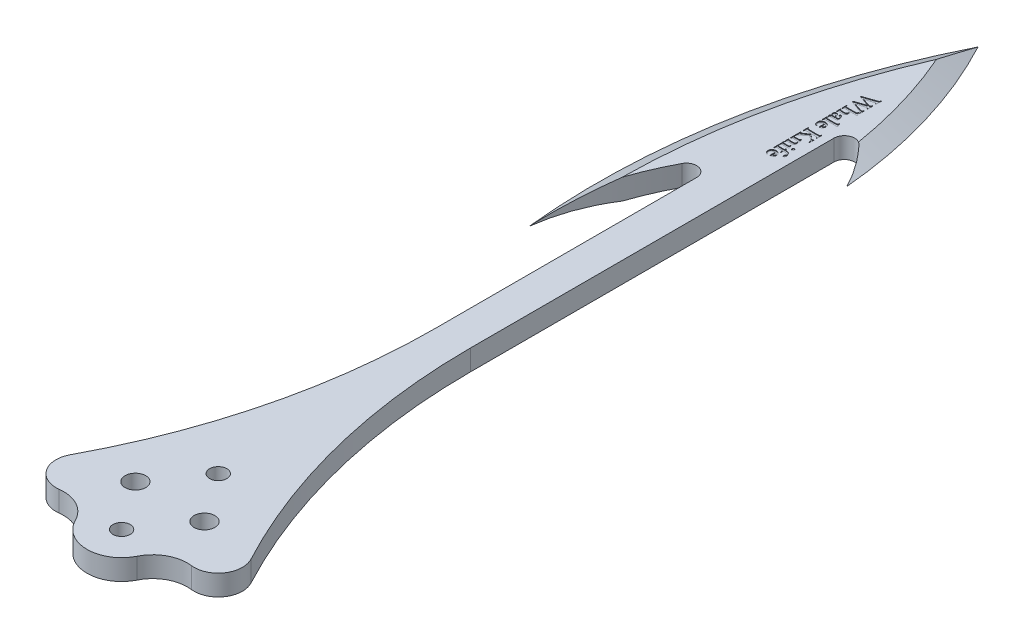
SolidWorks part; units mm, degrees
ref_plane "Front Plane" through (0, 0, 0) normal (0, 0, 1) x (1, 0, 0)
ref_plane "Top Plane" through (0, 0, 0) normal (0, 1, 0) x (1, 0, 0)
ref_plane "Right Plane" through (0, 0, 0) normal (1, 0, 0) x (0, 0, -1)
sketch "Sketch1" plane through (0, 0, 0) normal (0, 1, 0) x (1, 0, 0)
  line L0 (0, 0) -> (0, 120)
  line L1 (-10, 0) -> (10, 0)
  line L2 (-2.5, 0) -> (-2.5, 87)
  line L3 (2.5, 0) -> (2.5, 100)
  line L5 (-2.5, 0) -> (-2.5, 120) construction
  line L6 (2.5, 0) -> (2.5, 120) construction
  arc A0 (-4.481, -6.2182) -> (-9.5726, -3.4738) centre (-8.9621, -8.4364) ccw
  arc A1 (9.5726, -3.4738) -> (4.481, -6.2182) centre (8.9621, -8.4364) ccw
  circle A2 centre (-10, 0) radius 3.5
  circle A3 centre (10, 0) radius 3.5
  circle A4 centre (0, -4) radius 5
  arc A5 (0, 120) -> (-10, 65) centre (89.4656, 75.3244) ccw
  arc A6 (0, 120) -> (8, 93) centre (-61.7441, 87.0203) cw
  arc A7 (-10, 65) -> (-2.5, 87) centre (29.9772, 63.6498) cw
  arc A8 (8, 93) -> (2.5, 100) centre (-6.8344, 87.0051) ccw
  arc A9 (-13.0882, 1.6471) -> (-2.5, 44) centre (-92.5, 44) ccw
  arc A10 (2.5, 44) -> (13.0882, 1.6471) centre (92.5, 44) ccw
extrude "Boss-Extrude1" add sketch "Sketch1" along normal mid plane 3
fillet "Fillet1" radius 1.5 2 edges at (2.5, 0, -100) (-2.5, 0, -87)
chamfer "Chamfer1" distance 1.5 angle 60 1 edges at (-8.9214, 1.5, -93.213)
chamfer "Chamfer2" distance 1.5 angle 60 1 edges at (-8.9214, -1.5, -93.213)
chamfer "Chamfer3" distance 1.5 angle 60 1 edges at (5.8172, 1.5, -105.3361)
chamfer "Chamfer4" distance 1.5 angle 60 1 edges at (5.8172, -1.5, -105.3361)
sketch "Sketch2" plane through (0, 1.5, 0) normal (0, 1, 0) x (1, 0, 0)
  line L0 (-5, 3) -> (5, 3)
  line L1 (0, 10) -> (0, -4)
  circle A0 centre (-5, 3) radius 1.5
  circle A1 centre (5, 3) radius 1.5
  circle A2 centre (0, 10) radius 1.25
  circle A3 centre (0, -4) radius 1.25
extrude "Cut-Extrude1" cut sketch "Sketch2" against normal through all
sketch "Sketch3" plane through (0, 1.5, 0) normal (0, 1, 0) x (1, 0, 0)
  line L0 (0.7964, 103.1836) -> (0.7966, 103.172)
  line L1 (0.7966, 103.172) -> (-0.7008, 102.6592)
  line L2 (1.2033, 101.7026) -> (1.2037, 101.6428)
  line L3 (1.2239, 101.6231) -> (1.2931, 101.6228)
  line L4 (1.3054, 101.64) -> (1.3059, 102.2128)
  line L5 (1.2853, 102.2363) -> (1.2241, 102.236)
  line L6 (1.2033, 102.2158) -> (1.2037, 102.1372)
  line L7 (-0.2226, 102.4571) -> (-0.2225, 102.4684)
  line L8 (-0.2225, 102.4684) -> (1.0927, 102.8867)
  line L9 (1.2033, 102.8228) -> (1.2037, 102.7211)
  line L10 (1.2239, 102.7009) -> (1.2829, 102.7008)
  line L11 (1.3054, 102.7211) -> (1.3059, 103.4574)
  line L12 (1.2853, 103.4802) -> (1.2216, 103.4802)
  line L13 (1.2033, 103.4604) -> (1.2037, 103.4004)
  line L14 (-0.2143, 103.6597) -> (-0.2112, 103.6652)
  line L15 (-0.2112, 103.6652) -> (1.1041, 104.0837)
  line L16 (1.2033, 104.0156) -> (1.2037, 103.9613)
  line L17 (1.2239, 103.9357) -> (1.288, 103.9356)
  line L18 (1.3054, 103.9588) -> (1.3059, 104.6758)
  line L19 (1.2877, 104.6989) -> (1.2216, 104.6986)
  line L20 (1.2033, 104.6816) -> (1.2037, 104.6018)
  line L21 (1.1012, 104.4826) -> (-0.7179, 103.8521)
  line L22 (-0.5945, 100.7083) -> (-0.5945, 100.7598)
  line L23 (-0.6105, 100.7812) -> (-0.6733, 100.7811)
  line L24 (-0.6917, 100.7569) -> (-0.6917, 100.1761)
  line L25 (-0.6707, 100.1536) -> (-0.6129, 100.1533)
  line L26 (-0.5945, 100.182) -> (-0.5945, 100.233)
  line L27 (-0.55, 100.3302) -> (-0.1815, 100.3298)
  line L28 (-0.1815, 100.3298) -> (-0.014, 100.3298)
  line L29 (0.3372, 101.1288) -> (0.3376, 101.147)
  line L30 (0.3376, 101.147) -> (0.5154, 101.147)
  line L31 (1.1148, 101.6387) -> (1.0869, 101.6386)
  line L32 (1.0645, 101.6161) -> (1.0479, 101.5646)
  line L33 (0.7968, 101.434) -> (-0.2038, 101.4282)
  line L34 (-0.5945, 101.5362) -> (-0.5945, 101.6073)
  line L35 (-0.613, 101.633) -> (-0.6707, 101.6329)
  line L36 (-0.6917, 101.6103) -> (-0.6917, 101.0128)
  line L37 (-0.6657, 100.9888) -> (-0.6181, 100.9884)
  line L38 (-0.5945, 101.0193) -> (-0.5945, 101.0921)
  line L39 (-0.4775, 101.147) -> (0.1255, 101.147)
  line L40 (-0.0784, 100.6169) -> (-0.2652, 100.6165)
  line L41 (-0.5084, 98.8636) -> (-0.4857, 98.8974)
  line L42 (-0.3461, 99.091) -> (-0.2117, 99.091)
  line L43 (-0.2117, 99.091) -> (0.23, 99.0965)
  line L44 (0.1877, 99.378) -> (0.0427, 99.3776)
  line L45 (-0.5446, 99.3611) -> (-0.5445, 99.35)
  line L46 (-0.0632, 99.378) -> (-0.4308, 99.3776)
  line L47 (0.2725, 98.6132) -> (-0.4938, 98.6132)
  line L48 (-0.5945, 98.6844) -> (-0.5945, 98.7925)
  line L49 (-0.6159, 98.8327) -> (-0.6654, 98.8324)
  line L50 (-0.6917, 98.8097) -> (-0.6917, 98.1216)
  line L51 (-0.6657, 98.1045) -> (-0.6181, 98.1045)
  line L52 (-0.5945, 98.1387) -> (-0.5945, 98.2468)
  line L53 (-0.0076, 98.3265) -> (0.3955, 98.3265)
  line L54 (1.1308, 98.8438) -> (1.0974, 98.8438)
  line L55 (1.0748, 98.827) -> (1.0583, 98.7698)
  line L56 (0.3812, 98.6136) -> (0.2725, 98.6132)
  line L57 (0.02, 97.7203) -> (0.02, 97.0334)
  line L58 (-0.3651, 96.9332) -> (-0.3398, 96.9753)
  line L59 (-0.0661, 97.7203) -> (0.02, 97.7203)
  line L60 (0.1172, 97.364) -> (0.1172, 97.7117)
  line L61 (0.2836, 95.5588) -> (0.2836, 95.5079)
  line L62 (-0.5949, 94.9254) -> (-0.5946, 94.9646)
  line L63 (-0.6101, 94.9818) -> (-0.6737, 94.9816)
  line L64 (-0.6941, 94.9649) -> (-0.6941, 94.189)
  line L65 (-0.674, 94.1663) -> (-0.6099, 94.1662)
  line L66 (-0.592, 94.1894) -> (-0.592, 94.2516)
  line L67 (1.2033, 94.3994) -> (1.2037, 94.3426)
  line L68 (1.2239, 94.3204) -> (1.288, 94.3199)
  line L69 (1.3054, 94.3426) -> (1.3059, 94.9194)
  line L70 (1.2853, 94.9365) -> (1.2241, 94.9363)
  line L71 (1.2062, 94.9225) -> (1.2063, 94.8797)
  line L72 (0.3808, 95.5082) -> (0.3808, 95.5588)
  line L73 (0.3808, 95.5588) -> (0.5044, 95.5588)
  line L74 (1.2033, 95.4629) -> (1.2037, 95.3721)
  line L75 (1.2239, 95.3496) -> (1.288, 95.3494)
  line L76 (1.3054, 95.3723) -> (1.3059, 96.0747)
  line L77 (1.2902, 96.0975) -> (1.2216, 96.0975)
  line L78 (1.2033, 96.0749) -> (1.2037, 95.9893)
  line L79 (0.5208, 95.8986) -> (0.3579, 95.8982)
  line L80 (-0.592, 95.9839) -> (-0.592, 96.0861)
  line L81 (-0.6077, 96.1033) -> (-0.6763, 96.1032)
  line L82 (-0.6941, 96.0864) -> (-0.6941, 95.3721)
  line L83 (-0.674, 95.3554) -> (-0.6048, 95.3551)
  line L84 (-0.592, 95.378) -> (-0.592, 95.4853)
  line L85 (0.0723, 95.5588) -> (0.2836, 95.5588)
  line L86 (0.326, 94.1128) -> (0.3035, 94.1127)
  line L87 (0.275, 94.0901) -> (0.2639, 94.0672)
  line L88 (0.0995, 93.948) -> (-0.5378, 93.9476)
  line L89 (-0.5945, 94.0218) -> (-0.5945, 94.0786)
  line L90 (-0.6159, 94.1074) -> (-0.6654, 94.107)
  line L91 (-0.6917, 94.0901) -> (-0.6917, 93.546)
  line L92 (-0.6657, 93.5226) -> (-0.6181, 93.5224)
  line L93 (-0.5945, 93.5522) -> (-0.5945, 93.605)
  line L94 (-0.4985, 93.661) -> (0.0854, 93.661)
  line L95 (0.0653, 93.1573) -> (-0.2602, 93.1569)
  line L96 (-0.5945, 93.2219) -> (-0.5945, 93.2807)
  line L97 (-0.6159, 93.3162) -> (-0.6601, 93.316)
  line L98 (-0.6917, 93.2928) -> (-0.6917, 92.7136)
  line L99 (-0.6736, 92.691) -> (-0.6129, 92.6908)
  line L100 (-0.5945, 92.7252) -> (-0.5945, 92.8047)
  line L101 (-0.2436, 92.8706) -> (0.1647, 92.8702)
  line L102 (0.3429, 93.6523) -> (0.3432, 93.6691)
  line L103 (0.3432, 93.6691) -> (0.483, 93.691)
  line L104 (0.4937, 93.7788) -> (0.3545, 94.0843)
  line L105 (-0.5945, 92.4439) -> (-0.5945, 92.5689)
  line L106 (-0.6159, 92.5975) -> (-0.6654, 92.5974)
  line L107 (-0.6917, 92.5749) -> (-0.6917, 91.935)
  line L108 (-0.6657, 91.9122) -> (-0.6129, 91.9122)
  line L109 (-0.5945, 91.941) -> (-0.5945, 92.0545)
  line L110 (-0.2802, 92.1058) -> (0.0235, 92.1058)
  line L111 (0.3409, 92.5691) -> (0.31, 92.5689)
  line L112 (0.1102, 92.3928) -> (-0.2855, 92.3924)
  line L113 (0.9863, 92.1058) -> (0.9864, 92.1058)
  line L114 (0.3602, 91.3414) -> (0.3602, 91.0311)
  line L115 (0.373, 90.9942) -> (0.4656, 90.9798)
  line L116 (0.4887, 91.0028) -> (0.4887, 91.3414)
  line L117 (0.4887, 91.3414) -> (0.5784, 91.3414)
  line L118 (0.5419, 91.6284) -> (0.4887, 91.628)
  line L119 (0.4887, 91.628) -> (0.4887, 91.7874)
  line L120 (0.4755, 91.8245) -> (0.3885, 91.8358)
  line L121 (0.3598, 91.822) -> (0.3602, 91.628)
  line L122 (0.3602, 91.628) -> (-0.4973, 91.628)
  line L123 (-0.5945, 91.7022) -> (-0.5945, 91.8159)
  line L124 (-0.6105, 91.8447) -> (-0.6707, 91.8444)
  line L125 (-0.6917, 91.822) -> (-0.6917, 91.1165)
  line L126 (-0.6657, 91.0996) -> (-0.6181, 91.0994)
  line L127 (-0.5945, 91.128) -> (-0.5945, 91.2588)
  line L128 (0.1086, 91.3414) -> (0.3602, 91.3414)
  line L129 (0.02, 90.6033) -> (0.02, 89.9165)
  line L130 (-0.3651, 89.8162) -> (-0.3398, 89.8583)
  line L131 (-0.0661, 90.6033) -> (0.02, 90.6033)
  line L132 (0.1172, 90.247) -> (0.1172, 90.5947)
  spline S0 degree 3 poles (-0.7179, 103.8521) (-0.7308, 103.849) (-0.7548, 103.8349) (-0.764, 103.8086) (-0.7637, 103.7957) knots 0 0 0 0 0.508661 1 1 1 1
  spline S1 degree 3 poles (-0.7637, 103.7957) (-0.7618, 103.7798) (-0.7519, 103.7473) (-0.724, 103.7278) (-0.7094, 103.7219) knots 0 0 0 0 0.503971 1 1 1 1
  spline S2 degree 3 poles (-0.7094, 103.7219) (-0.6964, 103.7172) (-0.6719, 103.7086) (-0.6329, 103.6944) (-0.5894, 103.6789) (-0.5364, 103.6598) (-0.4739, 103.6371) (-0.4016, 103.6113) (-0.2341, 103.5512) (0.0265, 103.4573) (0.2882, 103.3639) (0.4585, 103.3029) (0.5335, 103.2761) (0.5994, 103.2526) (0.6562, 103.2325) (0.7041, 103.2155) (0.7498, 103.1997) (0.7796, 103.1892) (0.7964, 103.1836) knots 0 0 0 0 0.025988 0.048719 0.077721 0.112753 0.154386 0.202533 0.256709 0.488244 0.722134 0.777939 0.827714 0.871461 0.909178 0.940866 0.966768 1 1 1 1
  spline S3 degree 3 poles (-0.7008, 102.6592) (-0.717, 102.6552) (-0.7505, 102.6397) (-0.762, 102.6048) (-0.7637, 102.5885) knots 0 0 0 0 0.504998 1 1 1 1
  spline S4 degree 3 poles (-0.7637, 102.5885) (-0.7632, 102.5791) (-0.7591, 102.5655) (-0.7484, 102.55) (-0.727, 102.5323) (-0.7067, 102.5212) (-0.6896, 102.5148) knots 0 0 0 0 0.253597 0.376468 0.505659 1 1 1 1
  spline S5 degree 3 poles (-0.6896, 102.5148) (-0.6667, 102.5047) (-0.6271, 102.4881) (-0.5675, 102.464) (-0.5079, 102.4405) (-0.4386, 102.4134) (-0.3592, 102.3829) (-0.2699, 102.3488) (-0.0693, 102.2721) (0.2376, 102.1569) (0.5431, 102.0423) (0.7388, 101.9687) (0.8237, 101.9372) (0.8975, 101.9089) (0.9607, 101.8852) (1.0132, 101.8655) (1.0615, 101.8467) (1.0924, 101.8348) (1.1094, 101.8282) knots 0 0 0 0 0.03901 0.066931 0.100055 0.13886 0.182869 0.232561 0.287734 0.517462 0.743184 0.796179 0.843216 0.88417 0.919366 0.948404 0.971561 1 1 1 1
  spline S6 degree 3 poles (1.1094, 101.8282) (1.1245, 101.8215) (1.1452, 101.8094) (1.1685, 101.7891) (1.192, 101.7579) (1.2039, 101.7276) (1.2033, 101.7026) knots 0 0 0 0 0.297645 0.43121 0.556814 1 1 1 1
  spline S7 degree 3 poles (1.2037, 101.6428) (1.2033, 101.6373) (1.206, 101.6242) (1.219, 101.6217) (1.2239, 101.6231) knots 0 0 0 0 0.530048 1 1 1 1
  spline S8 degree 2 poles (1.2931, 101.6228) (1.3068, 101.6252) (1.3054, 101.64) knots 0 0 0 1 1 1
  spline S9 degree 3 poles (1.3059, 102.2128) (1.3059, 102.219) (1.3031, 102.2321) (1.2909, 102.2377) (1.2853, 102.2363) knots 0 0 0 0 0.542785 1 1 1 1
  spline S10 degree 3 poles (1.2241, 102.236) (1.2192, 102.2373) (1.2057, 102.235) (1.2036, 102.2212) (1.2033, 102.2158) knots 0 0 0 0 0.467009 1 1 1 1
  spline S11 degree 3 poles (1.2037, 102.1372) (1.2022, 102.1224) (1.2012, 102.1005) (1.1897, 102.0759) (1.1793, 102.0619) (1.1667, 102.0517) (1.149, 102.0415) (1.1339, 102.0382) (1.1238, 102.0387) knots 0 0 0 0 0.318444 0.449384 0.569347 0.682502 0.788889 1 1 1 1
  spline S12 degree 3 poles (1.1238, 102.0387) (1.0897, 102.0425) (1.034, 102.053) (0.954, 102.0727) (0.879, 102.0924) (0.7945, 102.1169) (0.7003, 102.1459) (0.5961, 102.1786) (0.4854, 102.2155) (0.3733, 102.2527) (0.266, 102.289) (0.1662, 102.3228) (0.074, 102.3541) (-0.011, 102.3828) (-0.109, 102.4169) (-0.1788, 102.4412) (-0.2226, 102.4571) knots 0 0 0 0 0.072903 0.120326 0.175254 0.237506 0.307386 0.384821 0.469629 0.555452 0.63583 0.710395 0.779424 0.842915 0.900965 1 1 1 1
  spline S13 degree 3 poles (1.0927, 102.8867) (1.1048, 102.8911) (1.1239, 102.8922) (1.1488, 102.8884) (1.1663, 102.8823) (1.1822, 102.8734) (1.1984, 102.8544) (1.2033, 102.8356) (1.2033, 102.8228) knots 0 0 0 0 0.256216 0.379413 0.505342 0.628167 0.741841 1 1 1 1
  spline S14 degree 3 poles (1.2037, 102.7211) (1.2033, 102.7157) (1.2066, 102.7035) (1.2187, 102.7002) (1.2239, 102.7009) knots 0 0 0 0 0.515562 1 1 1 1
  spline S15 degree 3 poles (1.2829, 102.7008) (1.2884, 102.6997) (1.3028, 102.7015) (1.3059, 102.7156) (1.3054, 102.7211) knots 0 0 0 0 0.504994 1 1 1 1
  spline S16 degree 3 poles (1.3059, 103.4574) (1.306, 103.4634) (1.3032, 103.4766) (1.2907, 103.4812) (1.2853, 103.4802) knots 0 0 0 0 0.542278 1 1 1 1
  spline S17 degree 3 poles (1.2216, 103.4802) (1.2162, 103.4807) (1.2065, 103.4757) (1.2023, 103.4657) (1.2033, 103.4604) knots 0 0 0 0 0.502979 1 1 1 1
  spline S18 degree 3 poles (1.2037, 103.4004) (1.203, 103.3824) (1.1946, 103.3442) (1.1673, 103.316) (1.1522, 103.3039) knots 0 0 0 0 0.481174 1 1 1 1
  spline S19 degree 3 poles (1.1522, 103.3039) (1.1313, 103.2874) (1.0821, 103.2647) (1.0292, 103.2524) (1.0015, 103.2528) knots 0 0 0 0 0.489905 1 1 1 1
  spline S20 degree 3 poles (1.0015, 103.2528) (0.9705, 103.2592) (0.9187, 103.2718) (0.8435, 103.2942) (0.7706, 103.3165) (0.6869, 103.3431) (0.5925, 103.3746) (0.4875, 103.4104) (0.3943, 103.4432) (0.3172, 103.4698) (0.2611, 103.4897) (0.208, 103.5087) (0.1578, 103.5264) (0.1104, 103.5427) (0.0662, 103.5584) (0.0252, 103.5734) (-0.0133, 103.5868) (-0.0486, 103.5998) (-0.0812, 103.6111) (-0.1106, 103.6219) (-0.1372, 103.6313) (-0.1606, 103.6401) (-0.1861, 103.6491) (-0.2036, 103.6558) (-0.2143, 103.6597) knots 0 0 0 0 0.073994 0.124496 0.183608 0.252355 0.329829 0.416342 0.511898 0.560844 0.607152 0.651128 0.692663 0.731758 0.768217 0.802344 0.83403 0.863383 0.890295 0.914875 0.936712 0.956217 0.97328 1 1 1 1
  spline S21 degree 3 poles (1.1041, 104.0837) (1.1175, 104.0872) (1.1374, 104.0907) (1.1618, 104.0859) (1.1765, 104.0795) (1.1877, 104.0683) (1.1995, 104.0476) (1.203, 104.0288) (1.2033, 104.0156) knots 0 0 0 0 0.289357 0.4051 0.511719 0.614061 0.725985 1 1 1 1
  spline S22 degree 3 poles (1.2037, 103.9613) (1.2038, 103.9547) (1.2051, 103.9401) (1.2184, 103.9344) (1.2239, 103.9357) knots 0 0 0 0 0.564891 1 1 1 1
  spline S23 degree 3 poles (1.288, 103.9356) (1.293, 103.9345) (1.305, 103.9397) (1.3055, 103.953) (1.3054, 103.9588) knots 0 0 0 0 0.439613 1 1 1 1
  spline S24 degree 3 poles (1.3059, 104.6758) (1.3058, 104.6814) (1.3042, 104.6937) (1.293, 104.6995) (1.2877, 104.6989) knots 0 0 0 0 0.534185 1 1 1 1
  spline S25 degree 2 poles (1.2216, 104.6986) (1.2047, 104.6984) (1.2033, 104.6816) knots 0 0 0 1 1 1
  spline S26 degree 3 poles (1.2037, 104.6018) (1.2041, 104.5782) (1.1939, 104.548) (1.1687, 104.5194) (1.1419, 104.5003) (1.1186, 104.4887) (1.1012, 104.4826) knots 0 0 0 0 0.417219 0.538345 0.672718 1 1 1 1
  spline S27 degree 3 poles (-0.2652, 100.6165) (-0.3172, 100.6172) (-0.382, 100.6165) (-0.4577, 100.6179) (-0.497, 100.6196) (-0.5234, 100.6205) (-0.5389, 100.6227) knots 0 0 0 0 0.569257 0.710663 0.829562 1 1 1 1
  spline S28 degree 3 poles (-0.5389, 100.6227) (-0.5487, 100.6242) (-0.5626, 100.6292) (-0.577, 100.642) (-0.5906, 100.6663) (-0.5947, 100.6898) (-0.5945, 100.7083) knots 0 0 0 0 0.264681 0.383825 0.503697 1 1 1 1
  spline S29 degree 3 poles (-0.5945, 100.7598) (-0.5943, 100.7651) (-0.5953, 100.7771) (-0.6061, 100.7817) (-0.6105, 100.7812) knots 0 0 0 0 0.565398 1 1 1 1
  spline S30 degree 3 poles (-0.6733, 100.7811) (-0.6786, 100.7826) (-0.6914, 100.7769) (-0.6917, 100.7629) (-0.6917, 100.7569) knots 0 0 0 0 0.446871 1 1 1 1
  spline S31 degree 3 poles (-0.6917, 100.1761) (-0.6913, 100.1705) (-0.6898, 100.1563) (-0.676, 100.1527) (-0.6707, 100.1536) knots 0 0 0 0 0.525122 1 1 1 1
  spline S32 degree 3 poles (-0.6129, 100.1533) (-0.6073, 100.1521) (-0.5944, 100.1595) (-0.5944, 100.1748) (-0.5945, 100.182) knots 0 0 0 0 0.402209 1 1 1 1
  spline S33 degree 3 poles (-0.5945, 100.233) (-0.5946, 100.2548) (-0.5938, 100.2825) (-0.5822, 100.3114) (-0.5712, 100.3253) (-0.5583, 100.3295) (-0.55, 100.3302) knots 0 0 0 0 0.559196 0.680852 0.78476 1 1 1 1
  spline S34 degree 3 poles (-0.014, 100.3298) (0.0243, 100.3292) (0.0812, 100.3288) (0.1554, 100.3352) (0.2085, 100.3419) (0.26, 100.3547) (0.3273, 100.3853) (0.3706, 100.4223) (0.3969, 100.4501) knots 0 0 0 0 0.259639 0.383485 0.503439 0.621384 0.740581 1 1 1 1
  spline S35 degree 3 poles (0.3969, 100.4501) (0.4144, 100.4694) (0.4399, 100.4986) (0.4667, 100.5414) (0.4837, 100.5739) (0.4968, 100.6089) (0.509, 100.6628) (0.5128, 100.7057) (0.5122, 100.7355) knots 0 0 0 0 0.24764 0.364497 0.478454 0.593635 0.717874 1 1 1 1
  spline S36 degree 3 poles (0.5122, 100.7355) (0.5124, 100.7725) (0.506, 100.828) (0.4875, 100.9006) (0.4678, 100.9541) (0.4432, 101.0053) (0.4029, 101.0668) (0.3656, 101.1067) (0.3372, 101.1288) knots 0 0 0 0 0.249147 0.375475 0.504777 0.633682 0.757584 1 1 1 1
  spline S37 degree 3 poles (0.5154, 101.147) (0.5403, 101.147) (0.5799, 101.147) (0.6356, 101.147) (0.6842, 101.147) (0.7374, 101.1469) (0.795, 101.1471) (0.8572, 101.1464) (0.922, 101.1467) (0.9858, 101.1461) (1.045, 101.1457) (1.0977, 101.1455) (1.1439, 101.1444) (1.1834, 101.1442) (1.2231, 101.1434) (1.2496, 101.1417) (1.2651, 101.1412) knots 0 0 0 0 0.099556 0.158334 0.223155 0.294018 0.370924 0.453875 0.542866 0.630211 0.709316 0.779632 0.841167 0.893905 0.937865 1 1 1 1
  spline S38 degree 3 poles (1.2651, 101.1412) (1.2811, 101.1406) (1.3098, 101.1327) (1.333, 101.1522) (1.3318, 101.1634) knots 0 0 0 0 0.635029 1 1 1 1
  spline S39 degree 3 poles (1.3318, 101.1634) (1.3322, 101.1758) (1.3261, 101.2019) (1.3136, 101.2254) (1.3096, 101.2392) knots 0 0 0 0 0.460296 1 1 1 1
  spline S40 degree 3 poles (1.3096, 101.2392) (1.2958, 101.266) (1.2742, 101.3086) (1.2449, 101.3689) (1.2206, 101.4193) (1.1973, 101.4697) (1.1718, 101.5289) (1.1564, 101.5717) (1.1481, 101.5988) knots 0 0 0 0 0.2292 0.362711 0.50977 0.654551 0.785029 1 1 1 1
  spline S41 degree 3 poles (1.1481, 101.5988) (1.1425, 101.6106) (1.1355, 101.6266) (1.121, 101.6404) (1.1148, 101.6387) knots 0 0 0 0 0.693552 1 1 1 1
  spline S42 degree 3 poles (1.0869, 101.6386) (1.0818, 101.6396) (1.0705, 101.634) (1.0665, 101.6222) (1.0645, 101.6161) knots 0 0 0 0 0.421305 1 1 1 1
  spline S43 degree 3 poles (1.0479, 101.5646) (1.0392, 101.543) (1.0238, 101.5118) (0.9924, 101.48) (0.9658, 101.4613) (0.9333, 101.4482) (0.8768, 101.4356) (0.8301, 101.4336) (0.7968, 101.434) knots 0 0 0 0 0.229513 0.333094 0.43449 0.545306 0.673733 1 1 1 1
  spline S44 degree 3 poles (-0.2038, 101.4282) (-0.2706, 101.4285) (-0.3529, 101.4295) (-0.4484, 101.4325) (-0.4971, 101.4354) (-0.5302, 101.4391) (-0.55, 101.4423) knots 0 0 0 0 0.577999 0.712303 0.826554 1 1 1 1
  spline S45 degree 3 poles (-0.55, 101.4423) (-0.5657, 101.4479) (-0.5925, 101.4768) (-0.5952, 101.5159) (-0.5945, 101.5362) knots 0 0 0 0 0.438948 1 1 1 1
  spline S46 degree 3 poles (-0.5945, 101.6073) (-0.594, 101.6134) (-0.5961, 101.6265) (-0.6076, 101.6326) (-0.613, 101.633) knots 0 0 0 0 0.541635 1 1 1 1
  spline S47 degree 3 poles (-0.6707, 101.6329) (-0.6761, 101.633) (-0.6902, 101.63) (-0.6922, 101.6158) (-0.6917, 101.6103) knots 0 0 0 0 0.499346 1 1 1 1
  spline S48 degree 3 poles (-0.6917, 101.0128) (-0.6915, 101.0065) (-0.6876, 100.9912) (-0.6721, 100.988) (-0.6657, 100.9888) knots 0 0 0 0 0.501727 1 1 1 1
  spline S49 degree 3 poles (-0.6181, 100.9884) (-0.6116, 100.9891) (-0.595, 100.9945) (-0.5942, 101.0123) (-0.5945, 101.0193) knots 0 0 0 0 0.475426 1 1 1 1
  spline S50 degree 3 poles (-0.5945, 101.0921) (-0.5946, 101.1011) (-0.5928, 101.1153) (-0.581, 101.1292) (-0.5691, 101.1369) (-0.5528, 101.142) (-0.5219, 101.1463) (-0.4962, 101.1474) (-0.4775, 101.147) knots 0 0 0 0 0.188784 0.272441 0.363436 0.476058 0.618049 1 1 1 1
  spline S51 degree 3 poles (0.1255, 101.147) (0.1524, 101.147) (0.2012, 101.1332) (0.2443, 101.1073) (0.2622, 101.0922) knots 0 0 0 0 0.533521 1 1 1 1
  spline S52 degree 3 poles (0.2622, 101.0922) (0.2926, 101.0607) (0.3405, 100.99) (0.3614, 100.9071) (0.3623, 100.8665) knots 0 0 0 0 0.519834 1 1 1 1
  spline S53 degree 3 poles (0.3623, 100.8665) (0.3622, 100.8346) (0.353, 100.771) (0.3172, 100.7176) (0.2956, 100.696) knots 0 0 0 0 0.511725 1 1 1 1
  spline S54 degree 3 poles (0.2956, 100.696) (0.276, 100.6765) (0.2396, 100.6529) (0.1832, 100.6343) (0.0814, 100.6171) (-0.007, 100.6156) (-0.0784, 100.6169) knots 0 0 0 0 0.210828 0.326179 0.45236 1 1 1 1
  spline S55 degree 3 poles (-0.5445, 99.35) (-0.5724, 99.3416) (-0.6112, 99.3236) (-0.6538, 99.2891) (-0.6781, 99.2602) (-0.6963, 99.2281) (-0.7135, 99.1814) (-0.7188, 99.1439) (-0.7184, 99.1186) knots 0 0 0 0 0.280176 0.404721 0.523526 0.640416 0.757194 1 1 1 1
  spline S56 degree 3 poles (-0.7184, 99.1186) (-0.717, 99.0826) (-0.7089, 99.0315) (-0.6827, 98.9711) (-0.6564, 98.9374) (-0.6285, 98.9105) (-0.5955, 98.8825) (-0.5705, 98.8654) (-0.5533, 98.8578) knots 0 0 0 0 0.331071 0.471427 0.601437 0.722165 0.828065 1 1 1 1
  spline S57 degree 3 poles (-0.5533, 98.8578) (-0.5436, 98.8557) (-0.5265, 98.8472) (-0.5098, 98.8567) (-0.5084, 98.8636) knots 0 0 0 0 0.623888 1 1 1 1
  spline S58 degree 3 poles (-0.4857, 98.8974) (-0.4826, 98.9011) (-0.4792, 98.9153) (-0.4932, 98.922) (-0.4973, 98.9262) knots 0 0 0 0 0.424956 1 1 1 1
  spline S59 degree 3 poles (-0.4973, 98.9262) (-0.511, 98.9342) (-0.5326, 98.963) (-0.5419, 98.9975) (-0.5418, 99.0172) knots 0 0 0 0 0.443069 1 1 1 1
  spline S60 degree 3 poles (-0.5418, 99.0172) (-0.5433, 99.0291) (-0.5371, 99.0468) (-0.5192, 99.0645) (-0.4991, 99.0747) (-0.4723, 99.0822) (-0.4208, 99.0905) (-0.3775, 99.0909) (-0.3461, 99.091) knots 0 0 0 0 0.151317 0.229566 0.323011 0.440459 0.590693 1 1 1 1
  spline S61 degree 3 poles (0.23, 99.0965) (0.2674, 99.0958) (0.3145, 99.0993) (0.3686, 99.1139) (0.4027, 99.1308) (0.425, 99.1488) (0.4385, 99.1626) knots 0 0 0 0 0.49817 0.621779 0.743418 1 1 1 1
  spline S62 degree 3 poles (0.4385, 99.1626) (0.4626, 99.1876) (0.4862, 99.2272) (0.5036, 99.2829) (0.5132, 99.3387) (0.5146, 99.3847) (0.5151, 99.4176) knots 0 0 0 0 0.379686 0.496488 0.638986 1 1 1 1
  spline S63 degree 3 poles (0.5151, 99.4176) (0.5149, 99.4626) (0.5089, 99.5288) (0.4907, 99.6141) (0.472, 99.6735) (0.4492, 99.7295) (0.4149, 99.7995) (0.3838, 99.8483) (0.361, 99.8788) knots 0 0 0 0 0.272762 0.402278 0.527902 0.650056 0.768849 1 1 1 1
  spline S64 degree 3 poles (0.361, 99.8788) (0.3457, 99.8989) (0.3212, 99.9274) (0.2831, 99.9583) (0.2534, 99.9769) (0.223, 99.991) (0.1834, 100.0058) (0.1523, 100.0097) (0.1321, 100.0098) knots 0 0 0 0 0.277679 0.409451 0.537377 0.660714 0.777469 1 1 1 1
  spline S65 degree 3 poles (0.1321, 100.0098) (0.1183, 100.009) (0.0978, 100.0064) (0.0745, 99.9936) (0.0608, 99.981) (0.0501, 99.9662) (0.0398, 99.9439) (0.0371, 99.9254) (0.0369, 99.913) knots 0 0 0 0 0.273864 0.397476 0.518237 0.638482 0.754789 1 1 1 1
  spline S66 degree 3 poles (0.0369, 99.913) (0.0375, 99.8873) (0.0427, 99.8504) (0.0609, 99.8071) (0.0791, 99.7821) (0.1025, 99.7631) (0.142, 99.7445) (0.1761, 99.7414) (0.1992, 99.7421) knots 0 0 0 0 0.287233 0.409052 0.519402 0.628013 0.741493 1 1 1 1
  spline S67 degree 3 poles (0.1992, 99.7421) (0.2273, 99.7421) (0.2597, 99.7496) (0.2977, 99.7531) (0.318, 99.7495) (0.3296, 99.7384) (0.3359, 99.731) knots 0 0 0 0 0.580588 0.68922 0.791117 1 1 1 1
  spline S68 degree 3 poles (0.3359, 99.731) (0.3539, 99.7068) (0.3768, 99.6525) (0.3864, 99.5945) (0.3862, 99.5658) knots 0 0 0 0 0.511395 1 1 1 1
  spline S69 degree 3 poles (0.3862, 99.5658) (0.3866, 99.5378) (0.384, 99.486) (0.3601, 99.4398) (0.3446, 99.4233) knots 0 0 0 0 0.557063 1 1 1 1
  spline S70 degree 3 poles (0.3446, 99.4233) (0.3252, 99.4048) (0.272, 99.3858) (0.2168, 99.3807) (0.1877, 99.378) knots 0 0 0 0 0.471436 1 1 1 1
  spline S71 degree 3 poles (0.0427, 99.3776) (0.0299, 99.3958) (0.0126, 99.4269) (-0.0112, 99.4716) (-0.0302, 99.5128) (-0.0517, 99.5591) (-0.0853, 99.6323) (-0.1121, 99.6901) (-0.1307, 99.7306) knots 0 0 0 0 0.169475 0.271042 0.38572 0.514934 0.660081 1 1 1 1
  spline S72 degree 3 poles (-0.1307, 99.7306) (-0.1514, 99.7735) (-0.1842, 99.8339) (-0.2422, 99.8981) (-0.2862, 99.9324) (-0.3323, 99.9561) (-0.3938, 99.9792) (-0.4426, 99.9849) (-0.4746, 99.9843) knots 0 0 0 0 0.315466 0.448091 0.568136 0.680706 0.788672 1 1 1 1
  spline S73 degree 3 poles (-0.4746, 99.9843) (-0.51, 99.9838) (-0.5606, 99.9771) (-0.6212, 99.9534) (-0.656, 99.9286) (-0.6836, 99.8997) (-0.7102, 99.8563) (-0.7187, 99.819) (-0.7184, 99.794) knots 0 0 0 0 0.30717 0.438759 0.561213 0.675981 0.783596 1 1 1 1
  spline S74 degree 3 poles (-0.7184, 99.794) (-0.7197, 99.7653) (-0.7184, 99.7042) (-0.7059, 99.6444) (-0.6983, 99.6132) knots 0 0 0 0 0.471941 1 1 1 1
  spline S75 degree 3 poles (-0.6983, 99.6132) (-0.6898, 99.5861) (-0.6751, 99.5475) (-0.6521, 99.4992) (-0.6167, 99.4373) (-0.5791, 99.3919) (-0.5446, 99.3611) knots 0 0 0 0 0.28457 0.414663 0.536917 1 1 1 1
  spline S76 degree 3 poles (-0.4308, 99.3776) (-0.4461, 99.3797) (-0.469, 99.3906) (-0.4957, 99.4149) (-0.5162, 99.4404) (-0.5352, 99.469) (-0.555, 99.5096) (-0.5633, 99.542) (-0.5656, 99.5638) knots 0 0 0 0 0.188184 0.305937 0.444487 0.59032 0.729895 1 1 1 1
  spline S77 degree 3 poles (-0.5656, 99.5638) (-0.5657, 99.5809) (-0.561, 99.6073) (-0.542, 99.6371) (-0.5236, 99.658) (-0.499, 99.6752) (-0.4561, 99.6924) (-0.4197, 99.6966) (-0.3943, 99.6972) knots 0 0 0 0 0.212222 0.319435 0.433396 0.553726 0.685868 1 1 1 1
  spline S78 degree 3 poles (-0.3943, 99.6972) (-0.3711, 99.6963) (-0.3374, 99.6916) (-0.2953, 99.6785) (-0.267, 99.6664) (-0.2416, 99.6504) (-0.2188, 99.6317) (-0.1984, 99.6102) (-0.1413, 99.5286) (-0.1015, 99.4477) (-0.0632, 99.378) knots 0 0 0 0 0.14218 0.207394 0.26994 0.330421 0.390224 0.450352 0.51179 1 1 1 1
  spline S79 degree 3 poles (-0.4938, 98.6132) (-0.5103, 98.6137) (-0.5332, 98.6168) (-0.5604, 98.6267) (-0.5834, 98.6453) (-0.595, 98.6667) (-0.5945, 98.6844) knots 0 0 0 0 0.359974 0.502513 0.62427 1 1 1 1
  spline S80 degree 3 poles (-0.5945, 98.7925) (-0.5961, 98.8025) (-0.5913, 98.8239) (-0.6089, 98.8355) (-0.6159, 98.8327) knots 0 0 0 0 0.633347 1 1 1 1
  spline S81 degree 3 poles (-0.6654, 98.8324) (-0.672, 98.8338) (-0.6869, 98.8303) (-0.6919, 98.8161) (-0.6917, 98.8097) knots 0 0 0 0 0.512163 1 1 1 1
  spline S82 degree 3 poles (-0.6917, 98.1216) (-0.6913, 98.1167) (-0.6854, 98.1046) (-0.6715, 98.1056) (-0.6657, 98.1045) knots 0 0 0 0 0.43507 1 1 1 1
  spline S83 degree 3 poles (-0.6181, 98.1045) (-0.6111, 98.102) (-0.5931, 98.1103) (-0.5948, 98.1303) (-0.5945, 98.1387) knots 0 0 0 0 0.423746 1 1 1 1
  spline S84 degree 3 poles (-0.5945, 98.2468) (-0.5941, 98.2595) (-0.5919, 98.2775) (-0.5806, 98.2972) (-0.555, 98.3168) (-0.5259, 98.3178) (-0.5051, 98.3212) knots 0 0 0 0 0.286795 0.399469 0.503039 1 1 1 1
  spline S85 degree 3 poles (-0.5051, 98.3212) (-0.4734, 98.3224) (-0.4207, 98.3247) (-0.3434, 98.3253) (-0.2725, 98.3262) (-0.1995, 98.3266) (-0.1109, 98.3265) (-0.0477, 98.3266) (-0.0076, 98.3265) knots 0 0 0 0 0.191315 0.317964 0.466131 0.61843 0.758312 1 1 1 1
  spline S86 degree 3 poles (0.3955, 98.3265) (0.4225, 98.3269) (0.4653, 98.3259) (0.5259, 98.3263) (0.5789, 98.3256) (0.637, 98.3254) (0.7001, 98.3243) (0.7682, 98.3242) (0.8396, 98.3232) (0.9109, 98.3225) (0.9788, 98.3216) (1.0417, 98.321) (1.0995, 98.3194) (1.1522, 98.319) (1.2125, 98.3169) (1.2552, 98.3167) (1.282, 98.3154) knots 0 0 0 0 0.091208 0.145098 0.205028 0.270533 0.341618 0.418737 0.50097 0.583203 0.659861 0.730946 0.795999 0.855471 0.909378 1 1 1 1
  spline S87 degree 3 poles (1.282, 98.3154) (1.295, 98.3171) (1.3181, 98.316) (1.3347, 98.3339) (1.3318, 98.343) knots 0 0 0 0 0.629647 1 1 1 1
  spline S88 degree 3 poles (1.3318, 98.343) (1.3316, 98.3504) (1.3273, 98.371) (1.3195, 98.3903) (1.3153, 98.4031) knots 0 0 0 0 0.354543 1 1 1 1
  spline S89 degree 3 poles (1.3153, 98.4031) (1.2991, 98.431) (1.2759, 98.4771) (1.2474, 98.5441) (1.2257, 98.6023) (1.2045, 98.6615) (1.1796, 98.7344) (1.1632, 98.7873) (1.1531, 98.8212) knots 0 0 0 0 0.215292 0.343836 0.485988 0.630085 0.763715 1 1 1 1
  spline S90 degree 2 poles (1.1531, 98.8212) (1.1483, 98.8398) (1.1308, 98.8438) knots 0 0 0 1 1 1
  spline S91 degree 3 poles (1.0974, 98.8438) (1.0929, 98.846) (1.0812, 98.8431) (1.0768, 98.8322) (1.0748, 98.827) knots 0 0 0 0 0.44852 1 1 1 1
  spline S92 degree 3 poles (1.0583, 98.7698) (1.0511, 98.7495) (1.0413, 98.7192) (1.0183, 98.6858) (1.0002, 98.6649) (0.9781, 98.6485) (0.9424, 98.631) (0.9115, 98.626) (0.8903, 98.6247) knots 0 0 0 0 0.271578 0.391623 0.504734 0.616375 0.73313 1 1 1 1
  spline S93 degree 3 poles (0.8903, 98.6247) (0.8627, 98.6229) (0.816, 98.6209) (0.7466, 98.6183) (0.6045, 98.6152) (0.4815, 98.6134) (0.3812, 98.6136) knots 0 0 0 0 0.162767 0.275259 0.409554 1 1 1 1
  spline S94 degree 3 poles (0.02, 97.0334) (0.0206, 97.0147) (0.0185, 96.9905) (0.0305, 96.9669) (0.0428, 96.9577) (0.0548, 96.9564) (0.0629, 96.9563) knots 0 0 0 0 0.565748 0.662956 0.760247 1 1 1 1
  spline S95 degree 3 poles (0.0629, 96.9563) (0.0815, 96.9554) (0.1106, 96.958) (0.1499, 96.9673) (0.1825, 96.9773) (0.2171, 96.99) (0.2533, 97.0063) (0.2917, 97.0252) (0.3311, 97.0469) (0.3696, 97.0722) (0.4044, 97.1026) (0.434, 97.1379) (0.4596, 97.1773) (0.4794, 97.2215) (0.502, 97.2878) (0.5092, 97.3416) (0.5122, 97.3784) knots 0 0 0 0 0.082096 0.12807 0.178063 0.232278 0.290561 0.353384 0.420605 0.489123 0.556052 0.623502 0.691862 0.762571 0.836672 1 1 1 1
  spline S96 degree 3 poles (0.5122, 97.3784) (0.5127, 97.434) (0.5093, 97.5138) (0.4893, 97.6128) (0.4692, 97.6755) (0.441, 97.7316) (0.3911, 97.8012) (0.3437, 97.8463) (0.3079, 97.8723) knots 0 0 0 0 0.298754 0.426755 0.541728 0.651555 0.762662 1 1 1 1
  spline S97 degree 3 poles (0.3079, 97.8723) (0.2723, 97.8983) (0.2193, 97.9328) (0.147, 97.9677) (0.0972, 97.9845) (0.0481, 97.9956) (-0.0198, 98.0064) (-0.0722, 98.0082) (-0.1077, 98.0073) knots 0 0 0 0 0.296297 0.423812 0.538755 0.648629 0.761622 1 1 1 1
  spline S98 degree 3 poles (-0.1077, 98.0073) (-0.1488, 98.0078) (-0.2096, 98.005) (-0.2887, 97.992) (-0.3458, 97.9787) (-0.4019, 97.9587) (-0.4779, 97.9201) (-0.5314, 97.882) (-0.5656, 97.8529) knots 0 0 0 0 0.249162 0.367973 0.485166 0.603539 0.728133 1 1 1 1
  spline S99 degree 3 poles (-0.5656, 97.8529) (-0.593, 97.83) (-0.6291, 97.7906) (-0.6657, 97.7302) (-0.6864, 97.6813) (-0.7013, 97.6283) (-0.717, 97.5495) (-0.7194, 97.4871) (-0.7193, 97.4443) knots 0 0 0 0 0.23653 0.351373 0.467296 0.587814 0.715927 1 1 1 1
  spline S100 degree 3 poles (-0.7193, 97.4443) (-0.7181, 97.408) (-0.7128, 97.3553) (-0.7008, 97.2877) (-0.6884, 97.242) (-0.6733, 97.1997) (-0.655, 97.1611) (-0.6341, 97.1258) (-0.6027, 97.0849) (-0.5618, 97.041) (-0.502, 96.9829) (-0.4535, 96.9491) (-0.4203, 96.9332) knots 0 0 0 0 0.174539 0.254455 0.330387 0.402041 0.469983 0.535443 0.599104 0.717843 0.823413 1 1 1 1
  spline S101 degree 3 poles (-0.4203, 96.9332) (-0.4084, 96.9291) (-0.3888, 96.9145) (-0.3665, 96.9244) (-0.3651, 96.9332) knots 0 0 0 0 0.637118 1 1 1 1
  spline S102 degree 3 poles (-0.3398, 96.9753) (-0.3367, 96.9799) (-0.3338, 96.9959) (-0.3488, 97.004) (-0.3539, 97.0086) knots 0 0 0 0 0.426517 1 1 1 1
  spline S103 degree 3 poles (-0.3539, 97.0086) (-0.3774, 97.0229) (-0.4086, 97.0512) (-0.4445, 97.0955) (-0.4686, 97.1345) (-0.4885, 97.1791) (-0.5091, 97.2497) (-0.5137, 97.3071) (-0.5146, 97.3467) knots 0 0 0 0 0.209969 0.320964 0.437433 0.561093 0.695222 1 1 1 1
  spline S104 degree 3 poles (-0.5146, 97.3467) (-0.515, 97.3686) (-0.5095, 97.401) (-0.4979, 97.4437) (-0.4843, 97.4749) (-0.4681, 97.5061) (-0.4468, 97.5359) (-0.4236, 97.5665) (-0.3962, 97.5956) (-0.3659, 97.6234) (-0.332, 97.6477) (-0.2949, 97.6684) (-0.2549, 97.6857) (-0.2118, 97.6996) (-0.1491, 97.7144) (-0.0997, 97.7188) (-0.0661, 97.7203) knots 0 0 0 0 0.101452 0.152682 0.205435 0.259812 0.316416 0.375666 0.438583 0.502444 0.567069 0.632374 0.699994 0.769991 0.842922 1 1 1 1
  spline S105 degree 3 poles (0.1172, 97.7117) (0.1613, 97.7041) (0.2235, 97.6875) (0.2963, 97.6513) (0.3392, 97.6204) (0.3728, 97.5843) (0.4054, 97.5282) (0.4148, 97.4797) (0.415, 97.4472) knots 0 0 0 0 0.307806 0.439145 0.557378 0.668984 0.77604 1 1 1 1
  spline S106 degree 3 poles (0.415, 97.4472) (0.4137, 97.4304) (0.4096, 97.4058) (0.3984, 97.3757) (0.3876, 97.3561) (0.3743, 97.3389) (0.3583, 97.3242) (0.3396, 97.312) (0.3123, 97.2986) (0.277, 97.2864) (0.2236, 97.272) (0.1834, 97.2682) (0.1576, 97.2693) knots 0 0 0 0 0.144871 0.211499 0.274674 0.335846 0.39661 0.460221 0.525971 0.657308 0.778836 1 1 1 1
  spline S107 degree 3 poles (0.1576, 97.2693) (0.1518, 97.2699) (0.1422, 97.2732) (0.134, 97.284) (0.1281, 97.2945) (0.1237, 97.3079) (0.1192, 97.3313) (0.1174, 97.3504) (0.1172, 97.364) knots 0 0 0 0 0.16117 0.253114 0.359175 0.484427 0.631792 1 1 1 1
  spline S108 degree 3 poles (0.2836, 95.5079) (0.2832, 95.491) (0.2777, 95.4548) (0.2557, 95.4254) (0.2433, 95.4118) knots 0 0 0 0 0.47816 1 1 1 1
  spline S109 degree 3 poles (0.2433, 95.4118) (0.2265, 95.3984) (0.1979, 95.3759) (0.154, 95.3437) (0.1104, 95.3121) (0.0598, 95.2753) (0.0016, 95.2342) (-0.0639, 95.1885) (-0.1344, 95.1396) (-0.2049, 95.0905) (-0.2707, 95.0451) (-0.3297, 95.0054) (-0.3813, 94.9701) (-0.426, 94.9401) (-0.4716, 94.9104) (-0.5023, 94.8908) (-0.5207, 94.8801) knots 0 0 0 0 0.06902 0.117414 0.175368 0.242526 0.31899 0.404766 0.500109 0.595453 0.681341 0.757776 0.824641 0.882671 0.931257 1 1 1 1
  spline S110 degree 3 poles (-0.5207, 94.8801) (-0.5351, 94.8735) (-0.5565, 94.8738) (-0.5784, 94.8847) (-0.5918, 94.8993) (-0.5934, 94.9153) (-0.5949, 94.9254) knots 0 0 0 0 0.447146 0.57261 0.695624 1 1 1 1
  spline S111 degree 2 poles (-0.5946, 94.9646) (-0.594, 94.9812) (-0.6101, 94.9818) knots 0 0 0 1 1 1
  spline S112 degree 3 poles (-0.6737, 94.9816) (-0.6784, 94.981) (-0.6919, 94.9817) (-0.6946, 94.9691) (-0.6941, 94.9649) knots 0 0 0 0 0.552448 1 1 1 1
  spline S113 degree 3 poles (-0.6941, 94.189) (-0.694, 94.1836) (-0.6939, 94.1686) (-0.6792, 94.1655) (-0.674, 94.1663) knots 0 0 0 0 0.516528 1 1 1 1
  spline S114 degree 3 poles (-0.6099, 94.1662) (-0.6053, 94.1656) (-0.5946, 94.1713) (-0.5934, 94.1836) (-0.592, 94.1894) knots 0 0 0 0 0.40574 1 1 1 1
  spline S115 degree 3 poles (-0.592, 94.2516) (-0.5926, 94.2796) (-0.5886, 94.3161) (-0.574, 94.3584) (-0.5566, 94.3895) (-0.5374, 94.4094) (-0.5236, 94.4221) knots 0 0 0 0 0.441395 0.570059 0.703721 1 1 1 1
  spline S116 degree 3 poles (-0.5236, 94.4221) (-0.4996, 94.4419) (-0.459, 94.4739) (-0.4, 94.5211) (-0.3435, 94.5648) (-0.2797, 94.6154) (-0.2076, 94.6713) (-0.1273, 94.7328) (-0.0422, 94.7991) (0.0438, 94.8652) (0.1252, 94.9281) (0.1998, 94.9858) (0.2673, 95.0381) (0.328, 95.085) (0.3947, 95.1376) (0.4417, 95.174) (0.4706, 95.1968) knots 0 0 0 0 0.074149 0.122986 0.179787 0.244241 0.316661 0.39705 0.485089 0.573387 0.65515 0.729921 0.797698 0.858483 0.912476 1 1 1 1
  spline S117 degree 3 poles (0.4706, 95.1968) (0.4941, 95.1781) (0.5315, 95.1492) (0.5823, 95.1063) (0.626, 95.0694) (0.6728, 95.0284) (0.7236, 94.9847) (0.777, 94.9366) (0.8331, 94.8868) (0.8887, 94.8366) (0.9406, 94.7879) (0.9878, 94.7422) (1.031, 94.7) (1.0687, 94.6599) (1.1109, 94.6137) (1.1398, 94.5802) (1.1559, 94.5576) knots 0 0 0 0 0.095856 0.151298 0.212304 0.278545 0.350068 0.426506 0.508227 0.589915 0.66565 0.735772 0.799988 0.858641 0.911437 1 1 1 1
  spline S118 degree 3 poles (1.1559, 94.5576) (1.1725, 94.5311) (1.1952, 94.4795) (1.2034, 94.4239) (1.2033, 94.3994) knots 0 0 0 0 0.561141 1 1 1 1
  spline S119 degree 3 poles (1.2037, 94.3426) (1.2028, 94.3374) (1.2054, 94.324) (1.2187, 94.3214) (1.2239, 94.3204) knots 0 0 0 0 0.485473 1 1 1 1
  spline S120 degree 3 poles (1.288, 94.3199) (1.2926, 94.3195) (1.3052, 94.3234) (1.3053, 94.3372) (1.3054, 94.3426) knots 0 0 0 0 0.44178 1 1 1 1
  spline S121 degree 3 poles (1.3059, 94.9194) (1.3058, 94.9235) (1.3035, 94.9363) (1.2899, 94.9357) (1.2853, 94.9365) knots 0 0 0 0 0.456489 1 1 1 1
  spline S122 degree 3 poles (1.2241, 94.9363) (1.2198, 94.9369) (1.2091, 94.9364) (1.2055, 94.9265) (1.2062, 94.9225) knots 0 0 0 0 0.540211 1 1 1 1
  spline S123 degree 3 poles (1.2063, 94.8797) (1.206, 94.8683) (1.2039, 94.8515) (1.1932, 94.8329) (1.183, 94.8226) (1.1693, 94.8168) (1.1451, 94.8174) (1.1281, 94.8278) (1.1164, 94.8348) knots 0 0 0 0 0.257286 0.367173 0.473407 0.576453 0.689875 1 1 1 1
  spline S124 degree 3 poles (1.1164, 94.8348) (1.1007, 94.8467) (1.0741, 94.868) (1.0343, 94.9001) (0.9938, 94.9319) (0.9474, 94.9702) (0.8937, 95.0132) (0.8338, 95.0623) (0.7691, 95.1148) (0.7047, 95.1679) (0.6443, 95.2172) (0.591, 95.2621) (0.5439, 95.3016) (0.5035, 95.3362) (0.4627, 95.3722) (0.4352, 95.3964) (0.4199, 95.4118) knots 0 0 0 0 0.06549 0.112775 0.1698 0.236143 0.312225 0.397981 0.493122 0.588551 0.674595 0.751835 0.81969 0.878455 0.928138 1 1 1 1
  spline S125 degree 3 poles (0.4199, 95.4118) (0.4073, 95.4261) (0.3883, 95.4565) (0.3796, 95.4915) (0.3808, 95.5082) knots 0 0 0 0 0.535867 1 1 1 1
  spline S126 degree 3 poles (0.5044, 95.5588) (0.5534, 95.5589) (0.633, 95.5575) (0.7472, 95.5554) (0.8299, 95.554) (0.8977, 95.5521) (0.9449, 95.5516) (0.9871, 95.5501) (1.024, 95.5493) (1.0559, 95.549) (1.088, 95.5485) (1.1095, 95.5481) (1.1222, 95.5477) knots 0 0 0 0 0.237949 0.386619 0.554627 0.639305 0.715973 0.783992 0.843998 0.895329 0.938661 1 1 1 1
  spline S127 degree 3 poles (1.1222, 95.5477) (1.1356, 95.5478) (1.1545, 95.5462) (1.1762, 95.5366) (1.1873, 95.5267) (1.1953, 95.5143) (1.203, 95.4931) (1.2037, 95.4752) (1.2033, 95.4629) knots 0 0 0 0 0.294834 0.407645 0.51186 0.615944 0.728034 1 1 1 1
  spline S128 degree 3 poles (1.2037, 95.3721) (1.2029, 95.3665) (1.2045, 95.3521) (1.2185, 95.3487) (1.2239, 95.3496) knots 0 0 0 0 0.515937 1 1 1 1
  spline S129 degree 3 poles (1.288, 95.3494) (1.293, 95.3484) (1.3049, 95.3535) (1.3055, 95.3666) (1.3054, 95.3723) knots 0 0 0 0 0.445279 1 1 1 1
  spline S130 degree 3 poles (1.3059, 96.0747) (1.3054, 96.0805) (1.3052, 96.0925) (1.2949, 96.0989) (1.2902, 96.0975) knots 0 0 0 0 0.584555 1 1 1 1
  spline S131 degree 3 poles (1.2216, 96.0975) (1.2163, 96.099) (1.2048, 96.0935) (1.2025, 96.0809) (1.2033, 96.0749) knots 0 0 0 0 0.448733 1 1 1 1
  spline S132 degree 3 poles (1.2037, 95.9893) (1.203, 95.9751) (1.2011, 95.9555) (1.1924, 95.9324) (1.1748, 95.9116) (1.1533, 95.9026) (1.1362, 95.904) knots 0 0 0 0 0.345402 0.475596 0.591863 1 1 1 1
  spline S133 degree 3 poles (1.1362, 95.904) (1.1237, 95.9042) (1.1019, 95.9033) (1.0686, 95.9037) (1.0344, 95.903) (0.9941, 95.9027) (0.9475, 95.9024) (0.8948, 95.9013) (0.838, 95.9011) (0.7809, 95.9009) (0.7273, 95.8997) (0.6793, 95.8996) (0.6369, 95.8989) (0.6001, 95.8992) (0.562, 95.8983) (0.5362, 95.8987) (0.5208, 95.8986) knots 0 0 0 0 0.060913 0.106426 0.161983 0.227579 0.303214 0.388896 0.484609 0.580323 0.667343 0.745655 0.814597 0.874166 0.925037 1 1 1 1
  spline S134 degree 3 poles (0.3579, 95.8982) (0.1672, 95.8996) (-0.0461, 95.8989) (-0.2793, 95.9024) (-0.3391, 95.9026) (-0.3912, 95.9034) (-0.4355, 95.9045) (-0.472, 95.9045) (-0.5054, 95.9059) (-0.5265, 95.9057) (-0.538, 95.9069) knots 0 0 0 0 0.638658 0.714043 0.780691 0.839072 0.888261 0.929171 0.961358 1 1 1 1
  spline S135 degree 3 poles (-0.538, 95.9069) (-0.5534, 95.9066) (-0.587, 95.9261) (-0.5906, 95.9653) (-0.592, 95.9839) knots 0 0 0 0 0.430153 1 1 1 1
  spline S136 degree 2 poles (-0.592, 96.0861) (-0.591, 96.1031) (-0.6077, 96.1033) knots 0 0 0 1 1 1
  spline S137 degree 3 poles (-0.6763, 96.1032) (-0.6807, 96.1031) (-0.692, 96.1018) (-0.6946, 96.0907) (-0.6941, 96.0864) knots 0 0 0 0 0.514301 1 1 1 1
  spline S138 degree 2 poles (-0.6941, 95.3721) (-0.6915, 95.3549) (-0.674, 95.3554) knots 0 0 0 1 1 1
  spline S139 degree 2 poles (-0.6048, 95.3551) (-0.5908, 95.3618) (-0.592, 95.378) knots 0 0 0 1 1 1
  spline S140 degree 3 poles (-0.592, 95.4853) (-0.5925, 95.5012) (-0.5803, 95.5358) (-0.546, 95.5487) (-0.5294, 95.5506) knots 0 0 0 0 0.483669 1 1 1 1
  spline S141 degree 3 poles (-0.5294, 95.5506) (-0.5173, 95.5516) (-0.4967, 95.5515) (-0.466, 95.5529) (-0.4355, 95.5529) (-0.4001, 95.554) (-0.3597, 95.5549) (-0.3144, 95.555) (-0.2492, 95.5563) (-0.1692, 95.5572) (-0.0564, 95.5581) (0.0229, 95.5593) (0.0723, 95.5588) knots 0 0 0 0 0.060267 0.10272 0.153368 0.212239 0.279321 0.354605 0.438109 0.604422 0.753621 1 1 1 1
  spline S142 degree 3 poles (0.3545, 94.0843) (0.3519, 94.0918) (0.3453, 94.105) (0.3325, 94.1128) (0.326, 94.1128) knots 0 0 0 0 0.563872 1 1 1 1
  spline S143 degree 3 poles (0.3035, 94.1127) (0.2975, 94.1136) (0.2844, 94.1088) (0.2773, 94.0968) (0.275, 94.0901) knots 0 0 0 0 0.449857 1 1 1 1
  spline S144 degree 3 poles (0.2639, 94.0672) (0.2488, 94.0352) (0.2231, 93.9973) (0.18, 93.9665) (0.1467, 93.9516) (0.1185, 93.9487) (0.0995, 93.948) knots 0 0 0 0 0.496425 0.613042 0.73449 1 1 1 1
  spline S145 degree 3 poles (-0.5378, 93.9476) (-0.5472, 93.9488) (-0.5618, 93.9506) (-0.5764, 93.9616) (-0.5915, 93.9824) (-0.5942, 94.005) (-0.5945, 94.0218) knots 0 0 0 0 0.277174 0.394409 0.511643 1 1 1 1
  spline S146 degree 3 poles (-0.5945, 94.0786) (-0.5945, 94.0856) (-0.5941, 94.1026) (-0.6097, 94.1091) (-0.6159, 94.1074) knots 0 0 0 0 0.55563 1 1 1 1
  spline S147 degree 3 poles (-0.6654, 94.107) (-0.6716, 94.107) (-0.6849, 94.1064) (-0.6917, 94.0953) (-0.6917, 94.0901) knots 0 0 0 0 0.570986 1 1 1 1
  spline S148 degree 3 poles (-0.6917, 93.546) (-0.6913, 93.5399) (-0.6878, 93.5241) (-0.6718, 93.5221) (-0.6657, 93.5226) knots 0 0 0 0 0.501776 1 1 1 1
  spline S149 degree 3 poles (-0.6181, 93.5224) (-0.6119, 93.5215) (-0.5937, 93.5257) (-0.5947, 93.5453) (-0.5945, 93.5522) knots 0 0 0 0 0.449173 1 1 1 1
  spline S150 degree 3 poles (-0.5945, 93.605) (-0.5951, 93.6141) (-0.5908, 93.6267) (-0.5809, 93.6415) (-0.5695, 93.6491) (-0.5561, 93.6557) (-0.5319, 93.6601) (-0.5125, 93.6623) (-0.4985, 93.661) knots 0 0 0 0 0.211841 0.3127 0.418132 0.533839 0.668075 1 1 1 1
  spline S151 degree 3 poles (0.0854, 93.661) (0.123, 93.6611) (0.1702, 93.6569) (0.2229, 93.6401) (0.2542, 93.6262) (0.2745, 93.6106) (0.2865, 93.5992) knots 0 0 0 0 0.524767 0.649178 0.768822 1 1 1 1
  spline S152 degree 3 poles (0.2865, 93.5992) (0.3003, 93.5825) (0.3193, 93.5577) (0.3375, 93.522) (0.354, 93.4776) (0.3604, 93.4396) (0.3598, 93.4106) knots 0 0 0 0 0.313932 0.450088 0.579811 1 1 1 1
  spline S153 degree 3 poles (0.3598, 93.4106) (0.3598, 93.3805) (0.3598, 93.3421) (0.3483, 93.298) (0.3356, 93.2678) (0.3199, 93.2476) (0.3092, 93.2339) knots 0 0 0 0 0.481508 0.598939 0.722062 1 1 1 1
  spline S154 degree 3 poles (0.3092, 93.2339) (0.2959, 93.2178) (0.2732, 93.1963) (0.237, 93.177) (0.2079, 93.168) (0.1764, 93.1626) (0.1288, 93.1566) (0.0912, 93.1572) (0.0653, 93.1573) knots 0 0 0 0 0.235253 0.34747 0.459613 0.577753 0.707204 1 1 1 1
  spline S155 degree 3 poles (-0.2602, 93.1569) (-0.3096, 93.1569) (-0.3985, 93.1585) (-0.4873, 93.1635) (-0.5265, 93.1688) knots 0 0 0 0 0.555403 1 1 1 1
  spline S156 degree 3 poles (-0.5265, 93.1688) (-0.5442, 93.1732) (-0.5784, 93.1787) (-0.597, 93.2085) (-0.5945, 93.2219) knots 0 0 0 0 0.600811 1 1 1 1
  spline S157 degree 3 poles (-0.5945, 93.2807) (-0.5954, 93.2894) (-0.5923, 93.3091) (-0.6092, 93.3189) (-0.6159, 93.3162) knots 0 0 0 0 0.606166 1 1 1 1
  spline S158 degree 3 poles (-0.6601, 93.316) (-0.6675, 93.3164) (-0.6859, 93.3163) (-0.6919, 93.2993) (-0.6917, 93.2928) knots 0 0 0 0 0.543329 1 1 1 1
  spline S159 degree 3 poles (-0.6917, 92.7136) (-0.6917, 92.7081) (-0.6912, 92.6945) (-0.6786, 92.69) (-0.6736, 92.691) knots 0 0 0 0 0.544615 1 1 1 1
  spline S160 degree 3 poles (-0.6129, 92.6908) (-0.6066, 92.6895) (-0.5941, 92.7003) (-0.5946, 92.7165) (-0.5945, 92.7252) knots 0 0 0 0 0.378191 1 1 1 1
  spline S161 degree 3 poles (-0.5945, 92.8047) (-0.5958, 92.8217) (-0.588, 92.8436) (-0.5681, 92.8617) (-0.5469, 92.871) (-0.5284, 92.8727) (-0.5154, 92.8731) knots 0 0 0 0 0.425139 0.540337 0.670322 1 1 1 1
  spline S162 degree 3 poles (-0.5154, 92.8731) (-0.4975, 92.8733) (-0.4687, 92.8727) (-0.4277, 92.8722) (-0.3549, 92.8714) (-0.2931, 92.8707) (-0.2436, 92.8706) knots 0 0 0 0 0.196971 0.318186 0.453037 1 1 1 1
  spline S163 degree 3 poles (0.1647, 92.8702) (0.1918, 92.8708) (0.2325, 92.872) (0.2835, 92.8861) (0.3199, 92.8995) (0.3549, 92.9193) (0.4014, 92.9576) (0.4322, 92.9936) (0.4508, 93.0205) knots 0 0 0 0 0.241366 0.355778 0.467761 0.583719 0.709976 1 1 1 1
  spline S164 degree 3 poles (0.4508, 93.0205) (0.4748, 93.0531) (0.5092, 93.1344) (0.516, 93.2222) (0.5147, 93.2689) knots 0 0 0 0 0.462197 1 1 1 1
  spline S165 degree 3 poles (0.5147, 93.2689) (0.5133, 93.3109) (0.503, 93.3934) (0.4705, 93.4698) (0.4508, 93.5049) knots 0 0 0 0 0.51143 1 1 1 1
  spline S166 degree 3 poles (0.4508, 93.5049) (0.4364, 93.5335) (0.4056, 93.5868) (0.3646, 93.6328) (0.3429, 93.6523) knots 0 0 0 0 0.523218 1 1 1 1
  spline S167 degree 3 poles (0.483, 93.691) (0.4916, 93.6929) (0.5082, 93.6999) (0.515, 93.7164) (0.5147, 93.724) knots 0 0 0 0 0.547309 1 1 1 1
  spline S168 degree 2 poles (0.5147, 93.724) (0.5096, 93.7534) (0.4937, 93.7788) knots 0 0 0 1 1 1
  spline S169 degree 2 poles (-0.2855, 92.3924) (-0.412, 92.3938) (-0.5385, 92.3982) knots 0 0 0 1 1 1
  spline S170 degree 3 poles (-0.5385, 92.3982) (-0.5529, 92.3996) (-0.5854, 92.4022) (-0.5977, 92.4319) (-0.5945, 92.4439) knots 0 0 0 0 0.570016 1 1 1 1
  spline S171 degree 3 poles (-0.5945, 92.5689) (-0.5942, 92.5757) (-0.5952, 92.5913) (-0.6095, 92.598) (-0.6159, 92.5975) knots 0 0 0 0 0.52945 1 1 1 1
  spline S172 degree 3 poles (-0.6654, 92.5974) (-0.6723, 92.5974) (-0.6883, 92.5957) (-0.6933, 92.5807) (-0.6917, 92.5749) knots 0 0 0 0 0.558396 1 1 1 1
  spline S173 degree 3 poles (-0.6917, 91.935) (-0.6915, 91.9289) (-0.6874, 91.9138) (-0.6719, 91.9117) (-0.6657, 91.9122) knots 0 0 0 0 0.494574 1 1 1 1
  spline S174 degree 3 poles (-0.6129, 91.9122) (-0.6073, 91.9107) (-0.5942, 91.9183) (-0.5946, 91.9337) (-0.5945, 91.941) knots 0 0 0 0 0.397937 1 1 1 1
  spline S175 degree 3 poles (-0.5945, 92.0545) (-0.5958, 92.0679) (-0.5748, 92.0962) (-0.5398, 92.0979) (-0.5216, 92.1004) knots 0 0 0 0 0.391926 1 1 1 1
  spline S176 degree 3 poles (-0.5216, 92.1004) (-0.5092, 92.1017) (-0.4884, 92.104) (-0.4572, 92.1045) (-0.3891, 92.1068) (-0.3295, 92.1052) (-0.2802, 92.1058) knots 0 0 0 0 0.154089 0.259869 0.387809 1 1 1 1
  spline S177 degree 3 poles (0.0235, 92.1058) (0.078, 92.1058) (0.1563, 92.1057) (0.256, 92.1059) (0.3199, 92.1055) (0.3749, 92.1045) (0.4278, 92.104) (0.4621, 92.1019) (0.4813, 92.1004) knots 0 0 0 0 0.356656 0.513158 0.653474 0.774911 0.873866 1 1 1 1
  spline S178 degree 3 poles (0.4813, 92.1004) (0.4892, 92.0999) (0.508, 92.0987) (0.5161, 92.1153) (0.5151, 92.1223) knots 0 0 0 0 0.558881 1 1 1 1
  spline S179 degree 2 poles (0.5151, 92.1223) (0.513, 92.1565) (0.4982, 92.1877) knots 0 0 0 1 1 1
  spline S180 degree 3 poles (0.4982, 92.1877) (0.4894, 92.2113) (0.4732, 92.2515) (0.4508, 92.3128) (0.4294, 92.3708) (0.4086, 92.4287) (0.3868, 92.4883) (0.3715, 92.5271) (0.3631, 92.5494) knots 0 0 0 0 0.195558 0.336663 0.507117 0.676203 0.814937 1 1 1 1
  spline S181 degree 2 poles (0.3631, 92.5494) (0.3589, 92.5677) (0.3409, 92.5691) knots 0 0 0 1 1 1
  spline S182 degree 3 poles (0.31, 92.5689) (0.3045, 92.5711) (0.2899, 92.5643) (0.2875, 92.5484) (0.2844, 92.5407) knots 0 0 0 0 0.381284 1 1 1 1
  spline S183 degree 3 poles (0.2844, 92.5407) (0.2774, 92.5137) (0.2648, 92.4767) (0.2388, 92.4362) (0.2176, 92.4168) (0.1937, 92.4048) (0.1584, 92.3934) (0.1296, 92.3921) (0.1102, 92.3928) knots 0 0 0 0 0.329955 0.45717 0.563905 0.664678 0.770262 1 1 1 1
  spline S184 degree 3 poles (0.9864, 92.1058) (1.0047, 92.1054) (1.0325, 92.1118) (1.0669, 92.1295) (1.0926, 92.1478) (1.1162, 92.1714) (1.14, 92.2143) (1.1459, 92.2521) (1.1473, 92.2779) knots 0 0 0 0 0.209782 0.321206 0.443289 0.570421 0.701073 1 1 1 1
  spline S185 degree 3 poles (1.1473, 92.2779) (1.1468, 92.3046) (1.1392, 92.3432) (1.1169, 92.3895) (1.0934, 92.4175) (1.0671, 92.441) (1.0289, 92.4641) (0.9965, 92.4711) (0.9751, 92.4719) knots 0 0 0 0 0.278523 0.407384 0.535413 0.659966 0.775601 1 1 1 1
  spline S186 degree 3 poles (0.9751, 92.4719) (0.9522, 92.4711) (0.9177, 92.4642) (0.8788, 92.4401) (0.8539, 92.4171) (0.8346, 92.3895) (0.8146, 92.3497) (0.8087, 92.3165) (0.8079, 92.2944) knots 0 0 0 0 0.256846 0.380362 0.50586 0.631888 0.752929 1 1 1 1
  spline S187 degree 3 poles (0.8079, 92.2944) (0.8088, 92.2657) (0.8155, 92.2242) (0.8404, 92.177) (0.8651, 92.1507) (0.893, 92.131) (0.9323, 92.111) (0.965, 92.1061) (0.9863, 92.1058) knots 0 0 0 0 0.297784 0.425514 0.547121 0.666146 0.778558 1 1 1 1
  spline S188 degree 3 poles (0.3602, 91.0311) (0.3595, 91.0224) (0.3598, 91.0083) (0.3673, 90.9955) (0.373, 90.9942) knots 0 0 0 0 0.624131 1 1 1 1
  spline S189 degree 3 poles (0.4656, 90.9798) (0.4708, 90.9778) (0.4851, 90.9815) (0.4876, 90.9964) (0.4887, 91.0028) knots 0 0 0 0 0.429764 1 1 1 1
  spline S190 degree 3 poles (0.5784, 91.3414) (0.6813, 91.3414) (0.8074, 91.3413) (0.9539, 91.3306) (1.0317, 91.3158) (1.0841, 91.295) (1.1139, 91.2763) knots 0 0 0 0 0.565745 0.693079 0.806934 1 1 1 1
  spline S191 degree 3 poles (1.1139, 91.2763) (1.1301, 91.2647) (1.152, 91.2459) (1.1747, 91.2167) (1.198, 91.1731) (1.2037, 91.1316) (1.2033, 91.0996) knots 0 0 0 0 0.287655 0.415261 0.532645 1 1 1 1
  spline S192 degree 3 poles (1.2033, 91.0996) (1.2037, 91.0786) (1.1887, 91.032) (1.1512, 91.0006) (1.1304, 90.9855) knots 0 0 0 0 0.443217 1 1 1 1
  spline S193 degree 3 poles (1.1304, 90.9855) (1.1151, 90.976) (1.0858, 90.9537) (1.0637, 90.9238) (1.0575, 90.906) knots 0 0 0 0 0.492842 1 1 1 1
  spline S194 degree 3 poles (1.0575, 90.906) (1.0494, 90.8934) (1.0375, 90.8636) (1.0347, 90.8317) (1.0353, 90.815) knots 0 0 0 0 0.471699 1 1 1 1
  spline S195 degree 3 poles (1.0353, 90.815) (1.0357, 90.799) (1.0416, 90.7748) (1.0569, 90.7444) (1.0727, 90.7218) (1.0918, 90.7012) (1.1235, 90.6807) (1.1511, 90.6736) (1.1699, 90.6725) knots 0 0 0 0 0.223742 0.344285 0.475673 0.609118 0.735678 1 1 1 1
  spline S196 degree 3 poles (1.1699, 90.6725) (1.1951, 90.6732) (1.2339, 90.6835) (1.2717, 90.7199) (1.2942, 90.755) (1.3106, 90.7971) (1.329, 90.8624) (1.331, 90.9155) (1.3318, 90.9517) knots 0 0 0 0 0.212471 0.317505 0.433031 0.559953 0.694776 1 1 1 1
  spline S197 degree 3 poles (1.3318, 90.9517) (1.3323, 90.9937) (1.3276, 91.0564) (1.3093, 91.1379) (1.2897, 91.1976) (1.2642, 91.2567) (1.2178, 91.3356) (1.1744, 91.391) (1.1419, 91.4262) knots 0 0 0 0 0.239831 0.358192 0.477196 0.598926 0.725996 1 1 1 1
  spline S198 degree 3 poles (1.1419, 91.4262) (1.1087, 91.4569) (1.0536, 91.5) (0.9696, 91.5441) (0.8995, 91.5743) (0.8217, 91.5983) (0.7023, 91.6218) (0.6074, 91.6279) (0.5419, 91.6284) knots 0 0 0 0 0.20951 0.321129 0.437747 0.562041 0.696752 1 1 1 1
  spline S199 degree 3 poles (0.4887, 91.7874) (0.4878, 91.7962) (0.4905, 91.8114) (0.481, 91.8238) (0.4755, 91.8245) knots 0 0 0 0 0.643377 1 1 1 1
  spline S200 degree 3 poles (0.3885, 91.8358) (0.3817, 91.8359) (0.3672, 91.8391) (0.3585, 91.8273) (0.3598, 91.822) knots 0 0 0 0 0.601438 1 1 1 1
  spline S201 degree 3 poles (-0.4973, 91.628) (-0.5113, 91.6281) (-0.5317, 91.6278) (-0.5559, 91.6355) (-0.5699, 91.6434) (-0.5812, 91.6539) (-0.5915, 91.6735) (-0.5947, 91.6903) (-0.5945, 91.7022) knots 0 0 0 0 0.301983 0.42487 0.536126 0.641512 0.748784 1 1 1 1
  spline S202 degree 3 poles (-0.5945, 91.8159) (-0.5946, 91.8234) (-0.5941, 91.8374) (-0.6053, 91.8462) (-0.6105, 91.8447) knots 0 0 0 0 0.626869 1 1 1 1
  spline S203 degree 3 poles (-0.6707, 91.8444) (-0.6762, 91.8457) (-0.6906, 91.8423) (-0.692, 91.8276) (-0.6917, 91.822) knots 0 0 0 0 0.487129 1 1 1 1
  spline S204 degree 3 poles (-0.6917, 91.1165) (-0.6916, 91.1115) (-0.6851, 91.0999) (-0.6716, 91.1005) (-0.6657, 91.0996) knots 0 0 0 0 0.434022 1 1 1 1
  spline S205 degree 3 poles (-0.6181, 91.0994) (-0.6119, 91.0985) (-0.5943, 91.1026) (-0.5943, 91.1212) (-0.5945, 91.128) knots 0 0 0 0 0.461195 1 1 1 1
  spline S206 degree 3 poles (-0.5945, 91.2588) (-0.5937, 91.2698) (-0.5926, 91.2864) (-0.5831, 91.3051) (-0.5741, 91.3163) (-0.5628, 91.3255) (-0.5433, 91.3355) (-0.5262, 91.3378) (-0.5146, 91.3389) knots 0 0 0 0 0.264577 0.380451 0.488696 0.601497 0.721725 1 1 1 1
  spline S207 degree 3 poles (-0.5146, 91.3389) (-0.5004, 91.3395) (-0.4775, 91.3406) (-0.4446, 91.3409) (-0.4145, 91.3414) (-0.3807, 91.3418) (-0.3432, 91.3423) (-0.3022, 91.3421) (-0.1512, 91.3423) (-0.0139, 91.3413) (0.1086, 91.3414) knots 0 0 0 0 0.068124 0.110426 0.158675 0.212873 0.273017 0.339107 0.410483 1 1 1 1
  spline S208 degree 3 poles (0.02, 89.9165) (0.0206, 89.8978) (0.0185, 89.8735) (0.0305, 89.8499) (0.0428, 89.8407) (0.0548, 89.8394) (0.0629, 89.8393) knots 0 0 0 0 0.565748 0.662956 0.760247 1 1 1 1
  spline S209 degree 3 poles (0.0629, 89.8393) (0.0815, 89.8385) (0.1106, 89.841) (0.1499, 89.8503) (0.1825, 89.8603) (0.2171, 89.873) (0.2533, 89.8894) (0.2917, 89.9082) (0.3311, 89.93) (0.3696, 89.9552) (0.4044, 89.9856) (0.434, 90.021) (0.4596, 90.0604) (0.4794, 90.1046) (0.502, 90.1708) (0.5092, 90.2247) (0.5122, 90.2615) knots 0 0 0 0 0.082096 0.12807 0.178063 0.232278 0.290561 0.353384 0.420605 0.489123 0.556052 0.623502 0.691862 0.762571 0.836672 1 1 1 1
  spline S210 degree 3 poles (0.5122, 90.2615) (0.5127, 90.317) (0.5093, 90.3968) (0.4893, 90.4958) (0.4692, 90.5585) (0.441, 90.6146) (0.3911, 90.6842) (0.3437, 90.7293) (0.3079, 90.7553) knots 0 0 0 0 0.298754 0.426755 0.541728 0.651555 0.762662 1 1 1 1
  spline S211 degree 3 poles (0.3079, 90.7553) (0.2723, 90.7813) (0.2193, 90.8158) (0.147, 90.8508) (0.0972, 90.8675) (0.0481, 90.8786) (-0.0198, 90.8895) (-0.0722, 90.8912) (-0.1077, 90.8904) knots 0 0 0 0 0.296297 0.423812 0.538755 0.648629 0.761622 1 1 1 1
  spline S212 degree 3 poles (-0.1077, 90.8904) (-0.1488, 90.8908) (-0.2096, 90.888) (-0.2887, 90.875) (-0.3458, 90.8617) (-0.4019, 90.8417) (-0.4779, 90.8032) (-0.5314, 90.765) (-0.5656, 90.7359) knots 0 0 0 0 0.249162 0.367973 0.485166 0.603539 0.728133 1 1 1 1
  spline S213 degree 3 poles (-0.5656, 90.7359) (-0.593, 90.713) (-0.6291, 90.6736) (-0.6657, 90.6132) (-0.6864, 90.5643) (-0.7013, 90.5113) (-0.717, 90.4325) (-0.7194, 90.3701) (-0.7193, 90.3274) knots 0 0 0 0 0.23653 0.351373 0.467296 0.587814 0.715927 1 1 1 1
  spline S214 degree 3 poles (-0.7193, 90.3274) (-0.7181, 90.2911) (-0.7128, 90.2384) (-0.7008, 90.1707) (-0.6884, 90.125) (-0.6733, 90.0827) (-0.655, 90.0441) (-0.6341, 90.0089) (-0.6027, 89.9679) (-0.5618, 89.9241) (-0.502, 89.8659) (-0.4535, 89.8321) (-0.4203, 89.8162) knots 0 0 0 0 0.174539 0.254455 0.330387 0.402041 0.469983 0.535443 0.599104 0.717843 0.823413 1 1 1 1
  spline S215 degree 3 poles (-0.4203, 89.8162) (-0.4084, 89.8121) (-0.3888, 89.7975) (-0.3665, 89.8074) (-0.3651, 89.8162) knots 0 0 0 0 0.637118 1 1 1 1
  spline S216 degree 3 poles (-0.3398, 89.8583) (-0.3367, 89.8629) (-0.3338, 89.8789) (-0.3488, 89.887) (-0.3539, 89.8916) knots 0 0 0 0 0.426517 1 1 1 1
  spline S217 degree 3 poles (-0.3539, 89.8916) (-0.3774, 89.9059) (-0.4086, 89.9342) (-0.4445, 89.9785) (-0.4686, 90.0176) (-0.4885, 90.0622) (-0.5091, 90.1327) (-0.5137, 90.1902) (-0.5146, 90.2297) knots 0 0 0 0 0.209969 0.320964 0.437433 0.561093 0.695222 1 1 1 1
  spline S218 degree 3 poles (-0.5146, 90.2297) (-0.515, 90.2517) (-0.5095, 90.2841) (-0.4979, 90.3267) (-0.4843, 90.3579) (-0.4681, 90.3892) (-0.4468, 90.419) (-0.4236, 90.4495) (-0.3962, 90.4786) (-0.3659, 90.5064) (-0.332, 90.5307) (-0.2949, 90.5515) (-0.2549, 90.5687) (-0.2118, 90.5827) (-0.1491, 90.5974) (-0.0997, 90.6019) (-0.0661, 90.6033) knots 0 0 0 0 0.101452 0.152682 0.205435 0.259812 0.316416 0.375666 0.438583 0.502444 0.567069 0.632374 0.699994 0.769991 0.842922 1 1 1 1
  spline S219 degree 3 poles (0.1172, 90.5947) (0.1613, 90.5871) (0.2235, 90.5705) (0.2963, 90.5343) (0.3392, 90.5035) (0.3728, 90.4673) (0.4054, 90.4113) (0.4148, 90.3628) (0.415, 90.3302) knots 0 0 0 0 0.307806 0.439145 0.557378 0.668984 0.77604 1 1 1 1
  spline S220 degree 3 poles (0.415, 90.3302) (0.4137, 90.3134) (0.4096, 90.2889) (0.3984, 90.2587) (0.3876, 90.2391) (0.3743, 90.222) (0.3583, 90.2072) (0.3396, 90.195) (0.3123, 90.1816) (0.277, 90.1695) (0.2236, 90.155) (0.1834, 90.1512) (0.1576, 90.1523) knots 0 0 0 0 0.144871 0.211499 0.274674 0.335846 0.39661 0.460221 0.525971 0.657308 0.778836 1 1 1 1
  spline S221 degree 3 poles (0.1576, 90.1523) (0.1518, 90.1529) (0.1422, 90.1563) (0.134, 90.1671) (0.1281, 90.1775) (0.1237, 90.1909) (0.1192, 90.2143) (0.1174, 90.2334) (0.1172, 90.247) knots 0 0 0 0 0.16117 0.253114 0.359175 0.484427 0.631792 1 1 1 1
extrude "Cut-Extrude2" cut sketch "Sketch3" against normal blind 0.1
equation "\"D6@Sketch1\"=\"D5@Sketch1\""
equation "\"D2@Sketch2\"=\"D1@Sketch2\""
